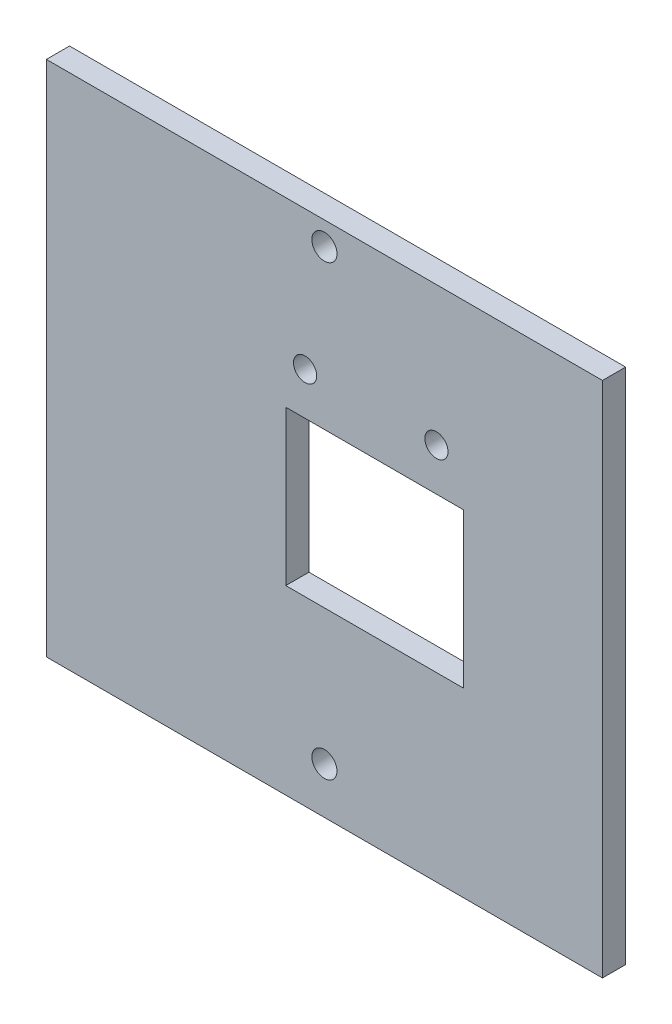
SolidWorks part; units mm, degrees
ref_plane "Alzado" through (0, 0, 0) normal (0, 0, 1) x (1, 0, 0)
ref_plane "Planta" through (0, 0, 0) normal (0, 1, 0) x (1, 0, 0)
ref_plane "Vista lateral" through (0, 0, 0) normal (1, 0, 0) x (0, 0, -1)
sketch "Croquis1" plane through (0, 0, 0) normal (0, 0, 1) x (1, 0, 0)
  line B0 (47.0497, -53.14) -> (47.0497, 13.86)
  line B1 (47.0497, 13.86) -> (119.0497, 13.86)
  line B2 (47.0497, -53.14) -> (119.0497, -53.14)
  line B3 (119.0497, -53.14) -> (119.0497, 13.86)
sketch_block_instance "Bloque-Croquis2-1"
sketch_block "Bloque-Croquis2" parameters "D1"=50, "D2"=59.9093
extrude "Saliente-Extruir1" add sketch "Croquis1" along normal blind 3
sketch "Croquis4" plane through (0, 0, 0) normal (0, 0, -1) x (-1, 0, 0)
  line L0 (-81.0497, -9.64) -> (-78.0497, -9.64)
  line L2 (-81.0497, -9.64) -> (-81.0497, -29.64) construction
  line L3 (-81.0497, -29.64) -> (-101.0497, -29.64)
  line L4 (-101.0497, -9.64) -> (-101.0497, -29.64)
  line L5 (-119.0497, -53.14) -> (-119.0497, 13.86) construction
  line L6 (-47.0497, -53.14) -> (-119.0497, -53.14) construction
  line L11 (-101.0497, -9.64) -> (-81.0497, -9.64)
  line L12 (-101.0497, -9.64) -> (-101.0497, -4.14) construction
  line L13 (-101.0497, -4.14) -> (-81.0497, -4.14) construction
  line L14 (-81.0497, -9.64) -> (-81.0497, -4.14) construction
  line L15 (-78.0497, -9.64) -> (-78.0497, -29.64)
  line L16 (-78.0497, -29.64) -> (-81.0497, -29.64)
  circle A0 centre (-83.0497, -47.14) radius 1.625 construction
  circle A1 centre (-83.0497, 10.86) radius 1.625 construction
  circle A2 centre (-83.0497, -47.14) radius 1.625
  circle A3 centre (-83.0497, 10.86) radius 1.625
  circle A4 centre (-97.5497, -4.14) radius 1.5
  circle A5 centre (-80.5497, -4.14) radius 1.5
  dimension "D6" = 3
  dimension "D7" = 3
  dimension "D8" = 3.5
  dimension "D9" = 0.5
  dimension "D1" = 18
  dimension "D2" = 23.5
  dimension "D3" = 20
  dimension "D4" = 20
  dimension "D5" = 5.5
  dimension "D10" = 3
extrude "Cortar-Extruir2" cut sketch "Croquis4" against normal blind 3
sketch "Sketch1" plane through (0, 0, 0) normal (0, 0, -1) x (-1, 0, 0)
  line L0 (-83.6116, -12.4258) -> (-83.5494, -12.5543)
  line L1 (-83.5494, -12.5543) -> (-83.55, -18.3154)
  line L2 (-84.8079, -22.1268) -> (-84.6335, -22.2149)
  line L3 (-84.6335, -22.2149) -> (-84.6335, -19.0751)
  line L4 (-84.6335, -19.0751) -> (-84.6335, -15.9352)
  line L5 (-84.6335, -15.9352) -> (-84.7287, -15.951)
  line L6 (-93.1219, -16.8922) -> (-93.1871, -16.9065)
  line L7 (-93.1871, -16.9065) -> (-93.1952, -21.1073)
  spline S0 degree 3 poles (-96.3379, -27.1087) (-97.2069, -26.9834) (-98.0152, -26.4605) (-98.3409, -25.8132) knots 0 0 0 0 1 1 1 1
  spline S1 degree 3 poles (-98.3409, -25.8132) (-98.4556, -25.5852) (-98.5501, -25.218) (-98.5494, -25.0029) knots 0 0 0 0 1 1 1 1
  spline S2 degree 3 poles (-98.5494, -25.0029) (-98.548, -24.5606) (-98.3543, -24.0931) (-98.0235, -23.7337) knots 0 0 0 0 1 1 1 1
  spline S3 degree 3 poles (-98.0235, -23.7337) (-97.1869, -22.8248) (-95.6406, -22.5917) (-94.451, -23.1952) knots 0 0 0 0 1 1 1 1
  spline S4 degree 3 poles (-94.451, -23.1952) (-94.37, -23.2363) (-94.2966, -23.2699) (-94.2881, -23.2699) knots 0 0 0 0 1 1 1 1
  spline S5 degree 3 poles (-94.2881, -23.2699) (-94.2795, -23.2699) (-94.2724, -21.122) (-94.2723, -18.4967) knots 0 0 0 0 1 1 1 1
  spline S6 degree 3 poles (-94.2723, -18.4967) (-94.2722, -15.1365) (-94.2627, -13.6888) (-94.2401, -13.6062) knots 0 0 0 0 1 1 1 1
  spline S7 degree 3 poles (-94.2401, -13.6062) (-94.1961, -13.4451) (-94.0945, -13.3193) (-93.9604, -13.2599) knots 0 0 0 0 1 1 1 1
  spline S8 degree 3 poles (-93.9604, -13.2599) (-93.8197, -13.1975) (-84.1494, -12.1117) (-83.9889, -12.1402) knots 0 0 0 0 1 1 1 1
  spline S9 degree 3 poles (-83.9889, -12.1402) (-83.8319, -12.1681) (-83.6809, -12.2824) (-83.6116, -12.4258) knots 0 0 0 0 1 1 1 1
  spline S10 degree 3 poles (-83.55, -18.3154) (-83.5505, -24.7354) (-83.536, -24.2886) (-83.7579, -24.7299) knots 0 0 0 0 1 1 1 1
  spline S11 degree 3 poles (-83.7579, -24.7299) (-84.1635, -25.5367) (-85.1318, -26.0561) (-86.2302, -26.0561) knots 0 0 0 0 1 1 1 1
  spline S12 degree 3 poles (-86.2302, -26.0561) (-86.8161, -26.0561) (-87.3138, -25.9267) (-87.8157, -25.6437) knots 0 0 0 0 1 1 1 1
  spline S13 degree 3 poles (-87.8157, -25.6437) (-88.0881, -25.4902) (-88.4949, -25.0993) (-88.6403, -24.8513) knots 0 0 0 0 1 1 1 1
  spline S14 degree 3 poles (-88.6403, -24.8513) (-89.0753, -24.1096) (-88.955, -23.2433) (-88.3284, -22.6064) knots 0 0 0 0 1 1 1 1
  spline S15 degree 3 poles (-88.3284, -22.6064) (-87.4672, -21.7309) (-85.9897, -21.5296) (-84.8079, -22.1268) knots 0 0 0 0 1 1 1 1
  spline S16 degree 3 poles (-84.7287, -15.951) (-84.7811, -15.9597) (-86.6763, -16.1718) (-88.9403, -16.4224) knots 0 0 0 0 1 1 1 1
  spline S17 degree 3 poles (-88.9403, -16.4224) (-91.2043, -16.673) (-93.086, -16.8844) (-93.1219, -16.8922) knots 0 0 0 0 1 1 1 1
  spline S18 degree 3 poles (-93.1952, -21.1073) (-93.2029, -25.112) (-93.2058, -25.3158) (-93.2578, -25.4695) knots 0 0 0 0 1 1 1 1
  spline S19 degree 3 poles (-93.2578, -25.4695) (-93.4602, -26.0693) (-93.8674, -26.5161) (-94.4876, -26.819) knots 0 0 0 0 1 1 1 1
  spline S20 degree 3 poles (-94.4876, -26.819) (-95.0477, -27.0925) (-95.7204, -27.1978) (-96.3379, -27.1087) knots 0 0 0 0 1 1 1 1
sketch "Croquis5" plane through (0, 0, 0) normal (0, 0, -1) x (-1, 0, 0)
  line L0 (-101.0497, -29.64) -> (-78.0497, -29.64) construction
  line L1 (-78.0497, -9.64) -> (-81.0497, -9.64) construction
  line L2 (-78.0497, -9.64) -> (-78.0497, -29.64) construction
  line L3 (-78.0497, -29.64) -> (-81.0497, -29.64) construction
  line L4 (-81.0497, -9.64) -> (-81.0497, -29.64)
  dimension "D1" = 3
